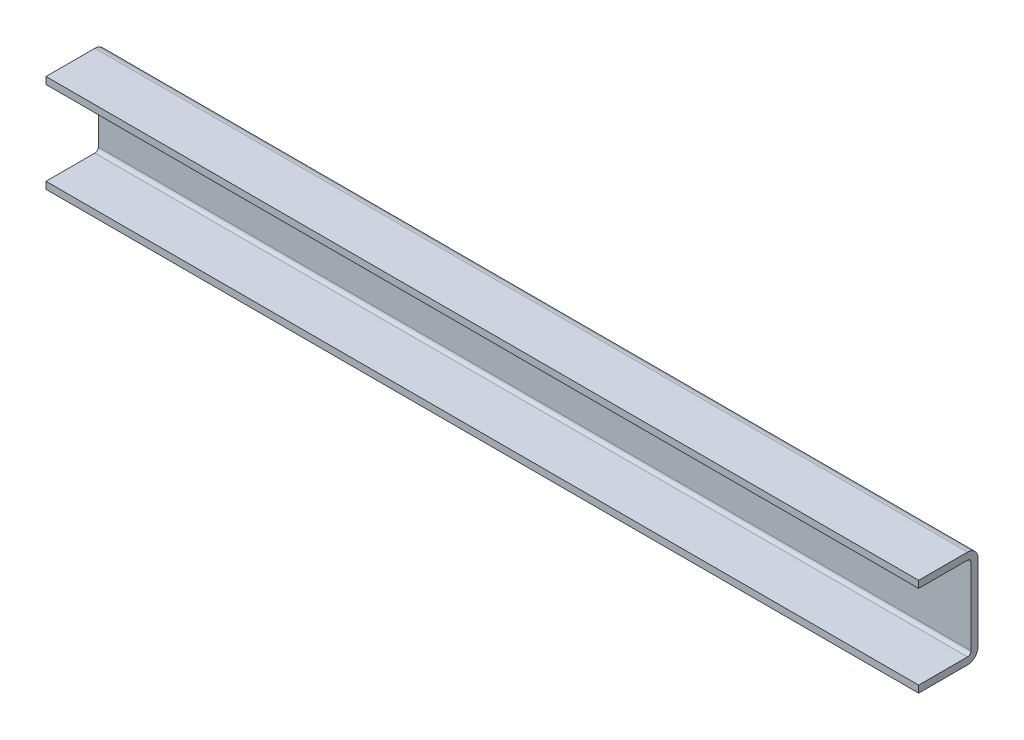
SolidWorks part; units mm, degrees
ref_plane "Plan de face" through (0, 0, 0) normal (0, 0, 1) x (1, 0, 0)
ref_plane "Plan de dessus" through (0, 0, 0) normal (0, 1, 0) x (1, 0, 0)
ref_plane "Plan de droite" through (0, 0, 0) normal (1, 0, 0) x (0, 0, -1)
ref_plane "Plan1" through (312.5, 0, 0) normal (1, 0, 0) x (0, 0, -1)
sketch "Esquisse1" plane through (312.5, 0, 0) normal (1, 0, 0) x (0, 0, -1)
  line L0 (0, 35) -> (0, 30)
  line L1 (0, 30) -> (35, 30)
  line L2 (37.5, 27.5) -> (37.5, -27.5)
  line L3 (35, -30) -> (0, -30)
  line L4 (0, -30) -> (0, -35)
  line L5 (0, -35) -> (35, -35)
  line L6 (42.5, -27.5) -> (42.5, 27.5)
  line L7 (35, 35) -> (0, 35)
  arc A0 (35, 30) -> (37.5, 27.5) centre (35, 27.5) cw
  arc A1 (37.5, -27.5) -> (35, -30) centre (35, -27.5) cw
  arc A2 (35, -35) -> (42.5, -27.5) centre (35, -27.5) ccw
  arc A3 (42.5, 27.5) -> (35, 35) centre (35, 27.5) ccw
extrude "Boss.-Extru.1" add sketch "Esquisse1" against normal blind 625
